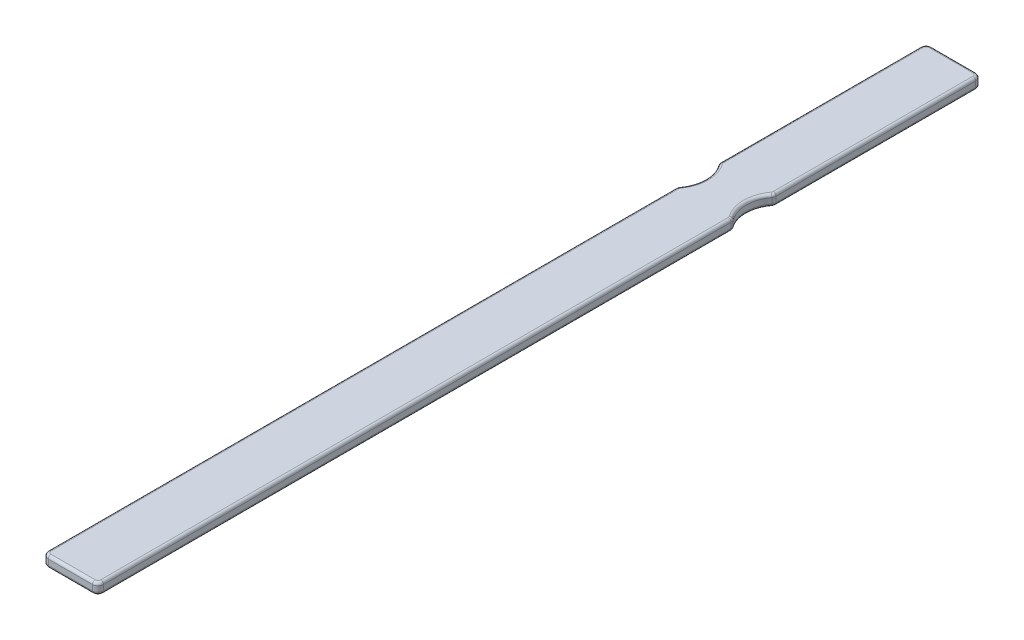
SolidWorks part; units mm, degrees
ref_plane "Front Plane" through (0, 0, 0) normal (0, 0, 1) x (1, 0, 0)
ref_plane "Top Plane" through (0, 0, 0) normal (0, 1, 0) x (1, 0, 0)
ref_plane "Right Plane" through (0, 0, 0) normal (1, 0, 0) x (0, 0, -1)
sketch "Sketch1" plane through (0, 0, 0) normal (0, 1, 0) x (1, 0, 0)
  line L0 (0, 0) -> (0, 320) construction
  line L1 (-10, 0) -> (10, 0)
  line L2 (-10, 0) -> (-10, 230)
  line L3 (-10, 320) -> (10, 320)
  line L4 (10, 0) -> (10, 230)
  line L5 (-10, 245) -> (-10, 320)
  line L6 (10, 245) -> (10, 320)
  arc A0 (10, 245) -> (10, 230) centre (19.3675, 237.5) ccw
  arc A1 (-10, 245) -> (-10, 230) centre (-19.3675, 237.5) cw
  point P11 (10, 165.5917)
  dimension "D3" = 75
  dimension "D5" = 12
  dimension "D1" = 320
  dimension "D2" = 20
  dimension "D4" = 15
extrude "Boss-Extrude1" add sketch "Sketch1" along normal blind 4
fillet "Fillet1" radius 2 8 edges at (10, 2, -245) (10, 2, -230) (-10, 2, -230) (-10, 2, -245) (-10, 2, 0) (10, 2, 0) (10, 2, -320) (-10, 2, -320)
fillet "Fillet2" radius 1 32 edges at (9.4142, 0, -319.4142) (0, 0, -320) (-9.4142, 0, -319.4142) (-10, 0, -281.836) (-9.9037, 0, -245.0587) (-7.3675, 0, -237.5) (-9.9037, 0, -229.9413) (-10, 0, -115.664) (-9.4142, 0, -0.5858) (0, 0, 0) (9.4142, 0, -0.5858) (10, 0, -115.664) (9.9037, 0, -229.9413) (7.3675, 0, -237.5) (9.9037, 0, -245.0587) (10, 0, -281.836) (9.9037, 4, -229.9413) (10, 4, -115.664) (9.4142, 4, -0.5858) (0, 4, 0) (-9.4142, 4, -0.5858) (-10, 4, -115.664) (-9.9037, 4, -229.9413) (-7.3675, 4, -237.5) (-9.9037, 4, -245.0587) (-10, 4, -281.836) (-9.4142, 4, -319.4142) (0, 4, -320) (9.4142, 4, -319.4142) (10, 4, -281.836) (9.9037, 4, -245.0587) (7.3675, 4, -237.5)
